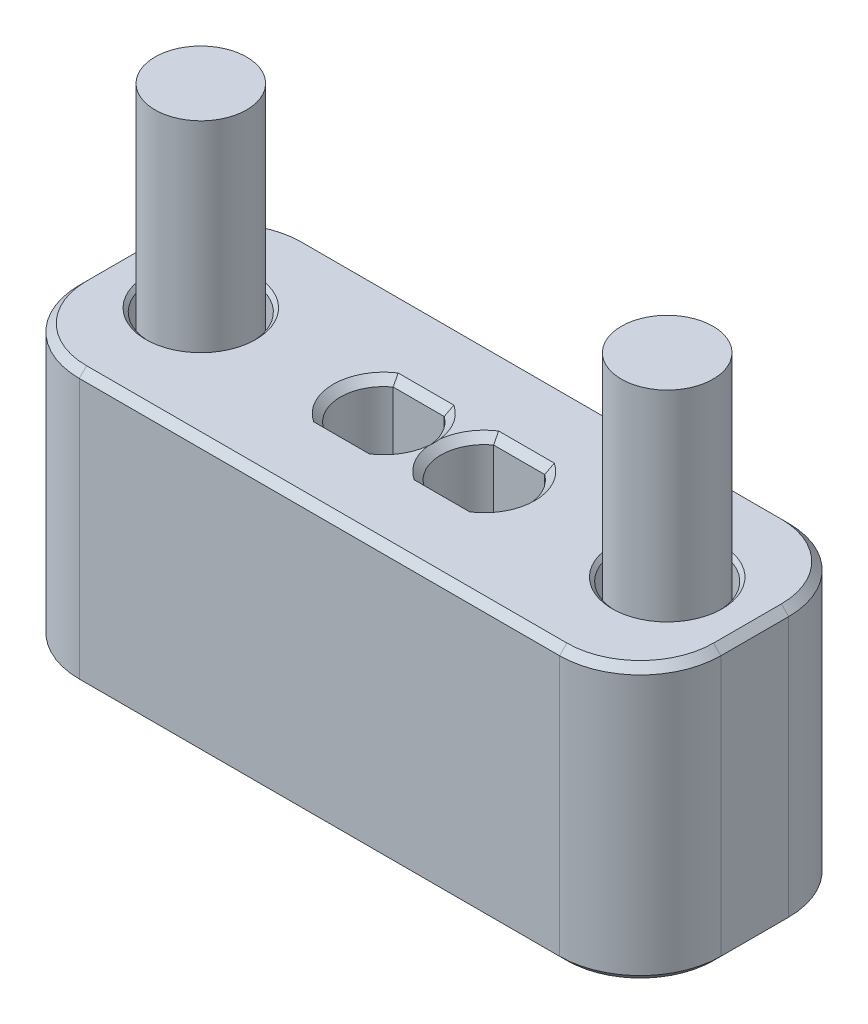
SolidWorks part; units mm, degrees
other "<SHCS25L1.00>-<HEX>"
ref_plane "Front Plane" through (0, 0, 0) normal (0, 0, 1) x (1, 0, 0)
ref_plane "Top Plane" through (0, 0, 0) normal (0, 1, 0) x (1, 0, 0)
ref_plane "Right Plane" through (0, 0, 0) normal (1, 0, 0) x (0, 0, -1)
sketch "Sketch1" plane through (0, 0, 0) normal (0, 1, 0) x (1, 0, 0)
  line L1 (-22.225, -7.9375) -> (22.225, -7.9375)
  line L2 (-22.225, -7.9375) -> (-22.225, 7.9375)
  line L3 (-22.225, 7.9375) -> (22.225, 7.9375)
  line L4 (22.225, -7.9375) -> (22.225, 7.9375)
  line L5 (-22.225, -7.9375) -> (22.225, 7.9375) construction
  line L6 (-22.225, 7.9375) -> (22.225, -7.9375) construction
  point P0 (0, 0)
  dimension "D1" = 44.45
  dimension "D2" = 15.875
extrude "Extrude1" add sketch "Sketch1" along normal blind 19.05
fillet "Fillet1" radius 5.588 4 edges at (-22.225, 9.525, -7.9375) (-22.225, 9.525, 7.9375) (22.225, 9.525, -7.9375) (22.225, 9.525, 7.9375)
sketch "Sketch4" plane through (0, 19.05, 0) normal (0, 1, 0) x (1, 0, 0)
  line L0 (-5.249, 2.4193) -> (-1.7106, 2.4193)
  line L1 (-0.2714, 0) -> (-16.7902, 0) construction
  line L2 (-5.249, -2.4194) -> (-1.7106, -2.4193)
  line L3 (0, 0) -> (0, 10.6435) construction
  line L4 (5.249, -2.4194) -> (1.7106, -2.4193)
  line L5 (5.249, 2.4194) -> (1.7106, 2.4193)
  arc A0 (-1.7106, -2.4193) -> (-1.7106, 2.4193) centre (-3.4798, 0) ccw
  arc A1 (-5.249, 2.4193) -> (-5.249, -2.4194) centre (-3.4798, 0) ccw
  arc A2 (5.249, 2.4194) -> (5.249, -2.4194) centre (3.4798, 0) cw
  arc A3 (1.7106, -2.4193) -> (1.7106, 2.4193) centre (3.4798, 0) cw
  dimension "D2" = 5.9944
  dimension "D3" = 3.4798
  dimension "D1" = 4.8387
extrude "Extrude2" cut sketch "Sketch4" against normal through all
chamfer "Chamfer2" distance 0.508 angle 45 16 edges at (-0.4826, 19.05, 0) (-3.4798, 19.05, 2.4193) (-6.477, 19.05, 0) (-3.4798, 19.05, -2.4193) (-3.4798, 0, 2.4193) (-0.4826, 0, 0) (-6.477, 0, 0) (-3.4798, 0, -2.4193) (0.4826, 0, 0) (3.4798, 0, 2.4193) (6.477, 0, 0) (3.4798, 0, -2.4194) (6.477, 19.05, 0) (3.4798, 19.05, 2.4193) (0.4826, 19.05, 0) (3.4798, 19.05, -2.4194)
sketch "Sketch3" plane through (0, 0, 0) normal (0, 0, 1) x (1, 0, 0)
  line L0 (-16.1544, -4.1204) -> (-16.1544, 20.8145) construction
  line L1 (-16.1544, 19.05) -> (-19.9644, 19.05)
  line L2 (-16.637, 19.05) -> (16.637, 19.05) construction
  line L3 (-19.7104, 7.112) -> (-21.3106, 7.112)
  line L4 (-21.3106, 7.112) -> (-21.3106, 0.508)
  line L5 (-19.7104, 18.796) -> (-19.7104, 7.112)
  line L6 (-16.637, 0) -> (16.637, 0) construction
  line L7 (-21.8186, 0) -> (-16.1544, 0)
  line L8 (-16.1544, 0) -> (-16.1544, 19.05)
  line L9 (-19.7104, 18.796) -> (-19.9644, 19.05)
  line L10 (-21.3106, 0.508) -> (-21.8186, 0)
  dimension "D1" = 16.1544
  dimension "D2" = 7.112
  dimension "D3" = 10.3124
  dimension "D4" = 0.508
  dimension "D5" = 45
  dimension "D6" = 0.254
  dimension "D7" = 45
  dimension "D8" = 7.112
revolve "Cut-Revolve2" cut sketch "Sketch3" angle 360 about L0
chamfer "Chamfer1" distance 0.508 angle 45 16 edges at (0, 0, -7.9375) (-20.5883, 0, -6.3008) (20.5883, 0, -6.3008) (-22.225, 0, 0) (22.225, 0, 0) (-20.5883, 0, 6.3008) (20.5883, 0, 6.3008) (0, 0, 7.9375) (0, 19.05, -7.9375) (-20.5883, 19.05, -6.3008) (20.5883, 19.05, -6.3008) (-22.225, 19.05, 0) (22.225, 19.05, 0) (-20.5883, 19.05, 6.3008) (20.5883, 19.05, 6.3008) (0, 19.05, 7.9375)
mirror "Mirror6" about plane through (0, 0, 0) normal (1, 0, 0) of "Cut-Revolve2"
inserted part "SHCS25L1.00"
move or copy body "Body-Move/Copy2" placed by mates yes
mirror "Mirror7" about plane through (0, 0, 0) normal (1, 0, 0)
